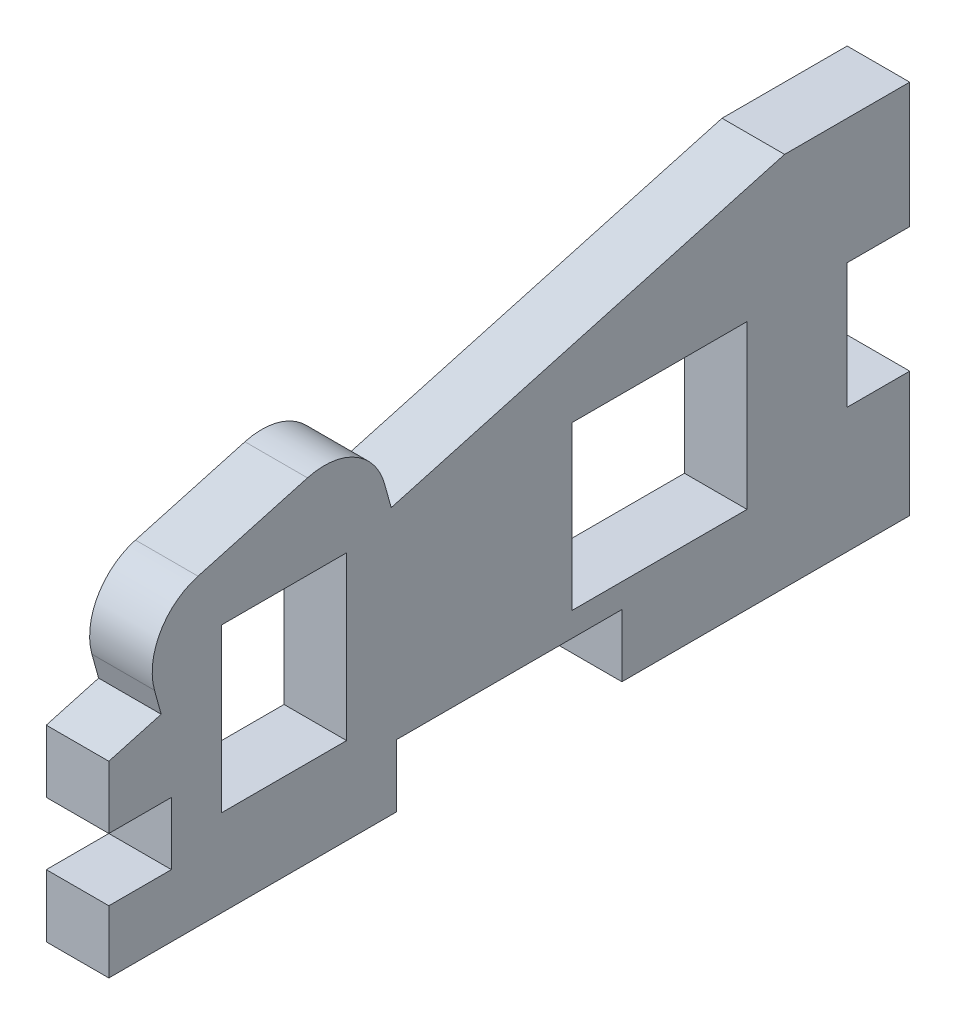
SolidWorks part; units mm, degrees
ref_plane "Plan de face" through (0, 0, 0) normal (0, 0, 1) x (1, 0, 0)
ref_plane "Plan de dessus" through (0, 0, 0) normal (0, 1, 0) x (1, 0, 0)
ref_plane "Plan de droite" through (0, 0, 0) normal (1, 0, 0) x (0, 0, -1)
sketch "Esquisse1" plane through (0, 0, 0) normal (1, 0, 0) x (0, 0, -1)
  line L2 (-19.6667, 5) -> (-19.6667, -10)
  line L3 (-19.6667, -10) -> (39.3333, -10)
  line L4 (39.3333, 20) -> (39.3333, -10)
  line L5 (-19.6667, 5) -> (39.3333, -10) construction
  line L6 (-19.6667, -10) -> (39.3333, 20) construction
  line L7 (-19.6667, 5) -> (34.3333, 20)
  line L8 (34.3333, 20) -> (39.3333, 20)
  point P0 (0, 0)
  dimension "D1" = 15
  dimension "D2" = 30
  dimension "D3" = 59
  dimension "D4" = 5
extrude "Boss.-Extru.1" add sketch "Esquisse1" along normal blind 5
sketch "Esquisse3" plane through (5, 0, 0) normal (1, 0, 0) x (0, 0, -1)
  line L0 (39.3333, 20) -> (39.3333, 10) construction
  line L1 (39.3333, 10) -> (39.3333, 0) construction
  line L2 (39.3333, 0) -> (39.3333, -10) construction
  line L9 (39.3333, -10) -> (39.3333, 20) construction
  line L11 (39.3333, 20) -> (44.3333, 20)
  line L12 (39.3333, 20) -> (39.3333, 10)
  line L13 (39.3333, 10) -> (44.3333, 10)
  line L14 (44.3333, 20) -> (44.3333, 10)
  line L15 (39.3333, 0) -> (44.3333, 0)
  line L16 (39.3333, 0) -> (39.3333, -10)
  line L17 (39.3333, -10) -> (44.3333, -10)
  line L18 (44.3333, 0) -> (44.3333, -10)
  dimension "D1" = 5
extrude "Boss.-Extru.2" add sketch "Esquisse3" against normal up to surface (5 mm away)
sketch "Esquisse4" plane through (5, 0, 0) normal (1, 0, 0) x (0, 0, -1)
  line L0 (-14.6667, -10) -> (3.3333, -10) construction
  line L1 (3.3333, -10) -> (21.3333, -10) construction
  line L2 (21.3333, -10) -> (39.3333, -10) construction
  line L3 (-19.6667, -10) -> (44.3333, -10) construction
  line L4 (44.3333, 0) -> (39.3333, 0) construction
  line L5 (3.3333, -10) -> (21.3333, -10)
  line L6 (3.3333, -10) -> (3.3333, -5)
  line L7 (3.3333, -5) -> (21.3333, -5)
  line L8 (21.3333, -10) -> (21.3333, -5)
  line L9 (-19.6667, 5) -> (-19.6667, 0) construction
  line L10 (-19.6667, 0) -> (-19.6667, -5) construction
  line L11 (-19.6667, -5) -> (-19.6667, -10) construction
  line L12 (-19.6667, 5) -> (-19.6667, -10) construction
  line L14 (-19.6667, -5) -> (-14.6667, -5)
  line L15 (-19.6667, -5) -> (-19.6667, 0)
  line L16 (-19.6667, 0) -> (-14.6667, 0)
  line L17 (-14.6667, -5) -> (-14.6667, 0)
extrude "Enlèv. mat.-Extru.1" cut sketch "Esquisse4" against normal through all both and the other way through all
sketch "Esquisse6" plane through (5, 0, 0) normal (1, 0, 0) x (0, 0, -1)
  line L0 (39.3333, 0) -> (39.3333, 10) construction
  line L1 (31.3333, -3.07) -> (17.3333, -3.07)
  line L2 (31.3333, -3.07) -> (31.3333, 9.93)
  line L3 (31.3333, 9.93) -> (17.3333, 9.93)
  line L4 (17.3333, -3.07) -> (17.3333, 9.93)
  line L5 (21.3333, -5) -> (3.3333, -5) construction
  line L7 (-10.6667, -3.07) -> (-0.6667, -3.07)
  line L8 (-10.6667, -3.07) -> (-10.6667, 9.93)
  line L9 (-10.6667, 9.93) -> (-0.6667, 9.93)
  line L10 (-0.6667, -3.07) -> (-0.6667, 9.93)
  dimension "D1" = 14
  dimension "D2" = 8
  dimension "D3" = 1.93
  dimension "D4" = 13
  dimension "D5" = 50
  dimension "D6" = 10
extrude "Enlèv. mat.-Extru.2" cut sketch "Esquisse6" against normal through all both and the other way through all
sketch "Esquisse7" plane through (5, 0, 0) normal (1, 0, 0) x (0, 0, -1)
  line L0 (34.3333, 20) -> (-1.9187, 9.93) construction
  line L1 (-10.6667, 7.5) -> (-19.6667, 5) construction
  line L2 (-10.6667, 7.5) -> (-1.9187, 9.93) construction
  line L4 (-15.4843, 6.1618) -> (-10.6667, 7.5)
  line L5 (-10.6667, 7.5) -> (-10.6667, 9.93)
  line L6 (-10.6667, 9.93) -> (-1.9187, 9.93)
  line L7 (-1.9187, 9.93) -> (2.8989, 11.2682)
  line L8 (-15.4843, 6.1618) -> (-17.3578, 12.9064)
  line L9 (-17.3578, 12.9064) -> (1.0254, 18.0128)
  line L10 (1.0254, 18.0128) -> (2.8989, 11.2682)
  dimension "D1" = 5
  dimension "D2" = 7
extrude "Boss.-Extru.3" add sketch "Esquisse7" against normal up to surface (5 mm away)
fillet "Congé1" radius 5 2 edges at (2.5, 18.0128, -1.0254) (2.5, 12.9064, 17.3578)
